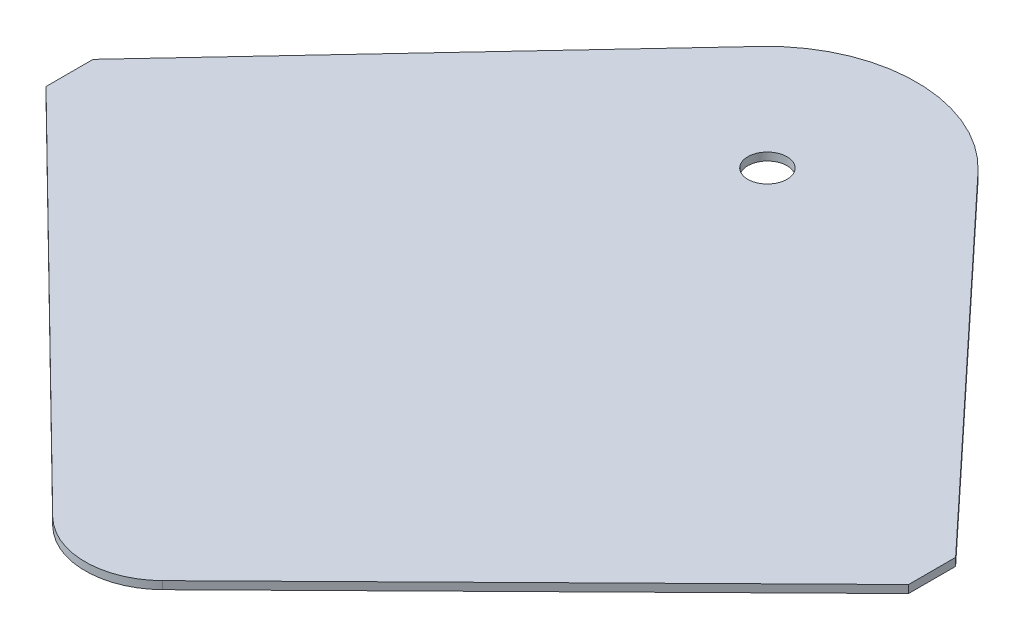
SolidWorks part; units mm, degrees
ref_plane "Front Plane" through (0, 0, 0) normal (0, 0, 1) x (1, 0, 0)
ref_plane "Top Plane" through (0, 0, 0) normal (0, 1, 0) x (1, 0, 0)
ref_plane "Right Plane" through (0, 0, 0) normal (1, 0, 0) x (0, 0, -1)
sketch "Sketch1" plane through (0, 0, 0) normal (0, 1, 0) x (1, 0, 0)
  line L0 (55, 46) -> (55, 40)
  line L1 (-55, 46) -> (-55, 40)
  line L2 (0, 0) -> (0, 77) construction
  line L3 (55, 46) -> (13.8779, 89.977)
  line L4 (55, 40) -> (7.007, -7.1346)
  line L5 (-55, 46) -> (-13.8779, 89.977)
  line L6 (-55, 40) -> (-7.007, -7.1346)
  line L7 (55, 40) -> (-55, 40) construction
  arc A0 (-7.007, -7.1346) -> (7.007, -7.1346) centre (0, 0) ccw
  arc A1 (13.8779, 89.977) -> (-13.8779, 89.977) centre (0, 77) ccw
  circle A2 centre (0, 77) radius 2.5
  dimension "D1" = 38
  dimension "D2" = 20
  dimension "D5" = 55
  dimension "D10" = 5
  dimension "D3" = 6
  dimension "D4" = 6
  dimension "D6" = 55
  dimension "D7" = 40
  dimension "D9" = 31
extrude "Extrude1" add sketch "Sketch1" along normal blind 1
